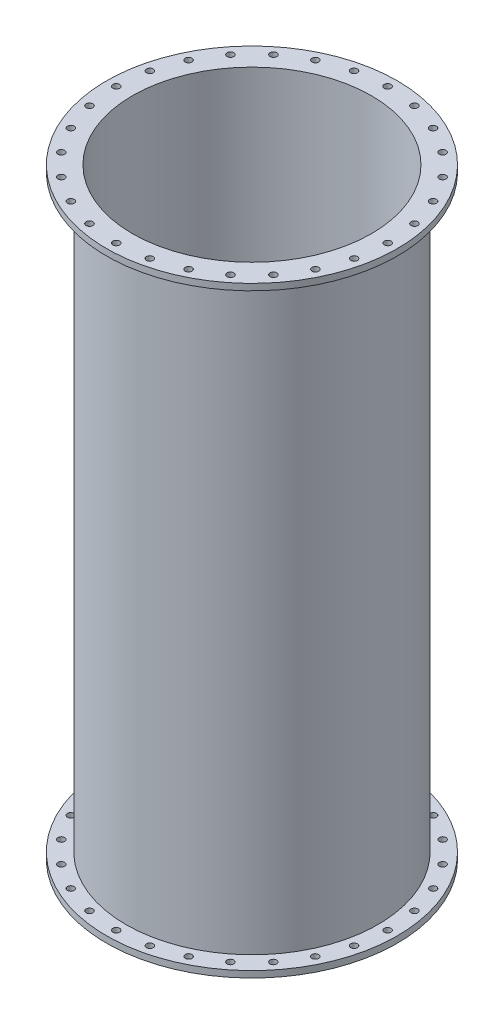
SolidWorks part; units mm, degrees
ref_plane "Alzado" through (0, 0, 0) normal (0, 0, 1) x (1, 0, 0)
ref_plane "Planta" through (0, 0, 0) normal (0, 1, 0) x (1, 0, 0)
ref_plane "Vista lateral" through (0, 0, 0) normal (1, 0, 0) x (0, 0, -1)
sketch "Croquis1" plane through (0, 0, 0) normal (0, 0, 1) x (1, 0, 0)
  line L0 (225, 0) -> (185, 0)
  line L1 (225, 0) -> (225, 10)
  line L2 (225, 10) -> (195, 10)
  line L3 (195, 10) -> (195, 921.1)
  line L4 (195, 921.1) -> (225, 921.1)
  line L5 (225, 921.1) -> (225, 931.1)
  line L6 (225, 931.1) -> (185, 931.1)
  line L7 (185, 931.1) -> (185, 0)
  line L8 (0, 0) -> (0, 1091.0698) construction
  dimension "D1" = 10
  dimension "D2" = 30
  dimension "D3" = 40
  dimension "D4" = 931.1
  dimension "D5" = 911.1
  dimension "D6" = 40
  dimension "D7" = 10
  dimension "D9" = 185
revolve "Revolución1" add sketch "Croquis1" angle 360 about L8
sketch "Croquis3" plane through (0, 931.1, 0) normal (0, 1, 0) x (1, 0, 0)
  line L0 (0, 0) -> (0, 210) construction
  circle A0 centre (0, 210) radius 5.25
  dimension "D1" = 10.5
  dimension "D2" = 210
extrude "Cortar-Extruir1" cut sketch "Croquis3" against normal through all
pattern_circular "MatrizC4" count 28 over 360 about axis through (0, 0, 0) along (0, 1, 0) of "Cortar-Extruir1"
